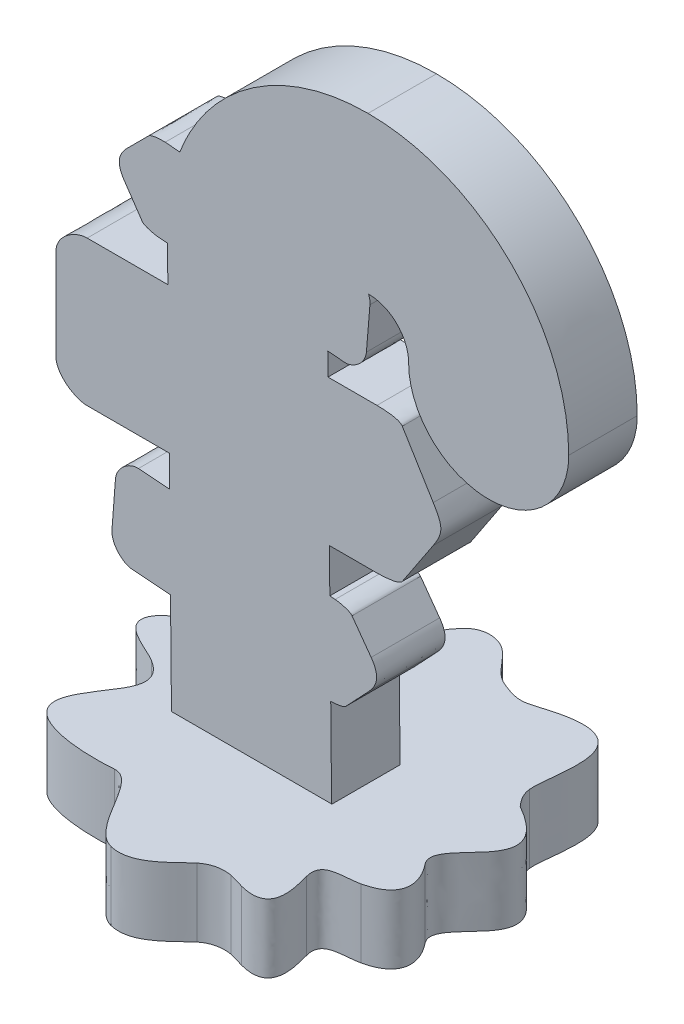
SolidWorks part; units mm, degrees
ref_plane "Front Plane" through (0, 0, 0) normal (0, 0, 1) x (1, 0, 0)
ref_plane "Top Plane" through (0, 0, 0) normal (0, 1, 0) x (1, 0, 0)
ref_plane "Right Plane" through (0, 0, 0) normal (1, 0, 0) x (0, 0, -1)
sketch "Sketch1" plane through (0, 0, 0) normal (0, 1, 0) x (1, 0, 0)
  spline S0 degree 3 poles (420.8176, 401.4154) (421.2862, 400.2379) (422.0432, 399.4519) (421.854, 398.1624) knots 0 0 0 0 0.047619 0.047619 0.047619 0.047619
  spline S1 degree 3 poles (421.854, 398.1624) (421.6954, 397.0807) (418.8198, 397.13) (417.9227, 396.1752) knots 0.047619 0.047619 0.047619 0.047619 0.095238 0.095238 0.095238 0.095238
  spline S2 degree 3 poles (417.9227, 396.1752) (416.2528, 394.3977) (419.3237, 393.6436) (420.4115, 392.9683) knots 0.095238 0.095238 0.095238 0.095238 0.142857 0.142857 0.142857 0.142857
  spline S3 degree 3 poles (420.4115, 392.9683) (423.0649, 391.3211) (420.2278, 389.6098) (419.5455, 387.4291) knots 0.142857 0.142857 0.142857 0.142857 0.190476 0.190476 0.190476 0.190476
  spline S4 degree 3 poles (419.5455, 387.4291) (418.6859, 384.6811) (424.0104, 384.5689) (425.9259, 384.7447) knots 0.190476 0.190476 0.190476 0.190476 0.238095 0.238095 0.238095 0.238095
  spline S5 degree 3 poles (425.9259, 384.7447) (427.5779, 384.8832) (428.6865, 380.2363) (430.6948, 379.7275) knots 0.238095 0.238095 0.238095 0.238095 0.285714 0.285714 0.285714 0.285714
  spline S6 degree 3 poles (430.6948, 379.7275) (432.5884, 379.2478) (433.9449, 381.0473) (434.8801, 381.8177) knots 0.285714 0.285714 0.285714 0.285714 0.333333 0.333333 0.333333 0.333333
  spline S7 degree 3 poles (434.8801, 381.8177) (435.3935, 382.2407) (436.0889, 382.4324) (436.8727, 382.2946) knots 0.333333 0.333333 0.333333 0.333333 0.380952 0.380952 0.380952 0.380952
  spline S8 degree 3 poles (436.8727, 382.2946) (437.1556, 382.2449) (437.654, 382.0683) (437.9809, 381.9822) knots 0.380952 0.380952 0.380952 0.380952 0.428571 0.428571 0.428571 0.428571
  spline S9 degree 3 poles (437.9809, 381.9822) (440.8072, 381.238) (440.0455, 383.7541) (439.7236, 384.9904) knots 0.428571 0.428571 0.428571 0.428571 0.47619 0.47619 0.47619 0.47619
  spline S10 degree 3 poles (439.7236, 384.9904) (439.3146, 386.5615) (441.0365, 386.2345) (442.178, 386.4862) knots 0.47619 0.47619 0.47619 0.47619 0.52381 0.52381 0.52381 0.52381
  spline S11 degree 3 poles (442.178, 386.4862) (444.4601, 386.9894) (444.547, 388.4992) (443.2653, 390.0937) knots 0.52381 0.52381 0.52381 0.52381 0.571429 0.571429 0.571429 0.571429
  spline S12 degree 3 poles (443.2653, 390.0937) (441.7873, 392.1014) (448.9236, 393.9394) (443.1314, 397.1708) knots 0.571429 0.571429 0.571429 0.571429 0.619048 0.619048 0.619048 0.619048
  spline S13 degree 3 poles (443.1314, 397.1708) (442.7526, 397.5732) (442.4255, 398.0599) (442.365, 398.6158) knots 0.619048 0.619048 0.619048 0.619048 0.666667 0.666667 0.666667 0.666667
  spline S14 degree 3 poles (442.365, 398.6158) (442.1632, 400.4684) (444.2579, 406.0472) (438.2903, 404.3764) knots 0.666667 0.666667 0.666667 0.666667 0.714286 0.714286 0.714286 0.714286
  spline S15 degree 3 poles (438.2903, 404.3764) (436.6482, 403.9166) (436.4757, 403.6768) (434.8514, 404.3426) knots 0.714286 0.714286 0.714286 0.714286 0.761905 0.761905 0.761905 0.761905
  spline S16 degree 3 poles (434.8514, 404.3426) (433.832, 404.7605) (433.4561, 405.6569) (432.609, 406.3887) knots 0.761905 0.761905 0.761905 0.761905 0.809524 0.809524 0.809524 0.809524
  spline S17 degree 3 poles (432.609, 406.3887) (431.7331, 407.1455) (430.4633, 407.1887) (429.7012, 406.3163) knots 0.809524 0.809524 0.809524 0.809524 0.857143 0.857143 0.857143 0.857143
  spline S18 degree 3 poles (429.7012, 406.3163) (428.0692, 404.4482) (428.9313, 402.9795) (425.0415, 403.8049) knots 0.857143 0.857143 0.857143 0.857143 0.904762 0.904762 0.904762 0.904762
  spline S19 degree 3 poles (425.0415, 403.8049) (422.8108, 404.2783) (419.6747, 404.2876) (420.8176, 401.4154) knots 0.904762 0.904762 0.904762 0.904762 1 1 1 1
extrude "Boss-Extrude1" add sketch "Sketch1" along normal blind 5
ref_plane "Plane2" through (0, 0, -392.9683) normal (0, 0, 1) x (1, 0, 0)
sketch "Sketch2" plane through (0, 0, -392.9683) normal (0, 0, 1) x (1, 0, 0)
  spline S0 degree 3 poles (424.9816, 40.6842) (427.0544, 46.1239) (432.4263, 50) (438.7223, 50) knots 0 0 0 0 0.020408 0.020408 0.020408 0.020408
  spline S1 degree 3 poles (438.7223, 50) (446.8134, 50) (453.3762, 43.5989) (453.3762, 35.7073) knots 0.020408 0.020408 0.020408 0.020408 0.040816 0.040816 0.040816 0.040816
  spline S2 degree 3 poles (453.3762, 35.7073) (453.3762, 32.5658) (450.7517, 30.006) (447.5308, 30.006) knots 0.040816 0.040816 0.040816 0.040816 0.061224 0.061224 0.061224 0.061224
  spline S3 degree 3 poles (447.5308, 30.006) (444.3098, 30.006) (441.6853, 32.5659) (441.6852, 35.7075) knots 0.061224 0.061224 0.061224 0.061224 0.081633 0.081633 0.081633 0.081633
  spline S4 degree 3 poles (441.6852, 35.7075) (441.6851, 37.293) (440.381, 38.5774) (438.7601, 38.5971) knots 0.081633 0.081633 0.081633 0.081633 0.102041 0.102041 0.102041 0.102041
  spline S5 degree 3 poles (438.7601, 38.5971) (438.8397, 38.399) (438.8796, 38.1845) (438.8614, 37.9644) knots 0.102041 0.102041 0.102041 0.102041 0.122449 0.122449 0.122449 0.122449
  spline S6 degree 2 poles (438.8614, 37.9644) (438.8614, 37.9644) (438.6032, 34.8407) knots 0.122449 0.122449 0.122449 0.142857 0.142857 0.142857
  spline S7 degree 3 poles (438.6032, 34.8407) (438.5321, 33.9804) (437.598, 33.3512) (437.0043, 33.4003) knots 0.142857 0.142857 0.142857 0.142857 0.163265 0.163265 0.163265 0.163265
  spline S8 degree 2 poles (437.0043, 33.4003) (437.0043, 33.4003) (435.7812, 33.5014) knots 0.163265 0.163265 0.163265 0.183673 0.183673 0.183673
  spline S9 degree 2 poles (435.7812, 33.5014) (435.7812, 33.5014) (435.7973, 31.8611) knots 0.183673 0.183673 0.183673 0.204082 0.204082 0.204082
  spline S10 degree 2 poles (435.7973, 31.8611) (435.7973, 31.8611) (439.3749, 31.8611) knots 0.204082 0.204082 0.204082 0.22449 0.22449 0.22449
  spline S11 degree 3 poles (439.3749, 31.8611) (439.7509, 31.8611) (441.0046, 31.8284) (441.2255, 31.4666) knots 0.22449 0.22449 0.22449 0.22449 0.244898 0.244898 0.244898 0.244898
  spline S12 degree 2 poles (441.2255, 31.4666) (441.2255, 31.4666) (443.4844, 27.7666) knots 0.244898 0.244898 0.244898 0.265306 0.265306 0.265306
  spline S13 degree 3 poles (443.4844, 27.7666) (444.2187, 26.564) (444.2263, 26.1723) (443.4844, 25.0556) knots 0.265306 0.265306 0.265306 0.265306 0.285714 0.285714 0.285714 0.285714
  spline S14 degree 2 poles (443.4844, 25.0556) (443.4844, 25.0556) (441.2255, 21.6556) knots 0.285714 0.285714 0.285714 0.306122 0.306122 0.306122
  spline S15 degree 3 poles (441.2255, 21.6556) (440.9932, 21.3059) (439.7495, 21.2611) (439.3749, 21.2611) knots 0.306122 0.306122 0.306122 0.306122 0.326531 0.326531 0.326531 0.326531
  spline S16 degree 2 poles (439.3749, 21.2611) (439.3749, 21.2611) (435.9019, 21.2611) knots 0.326531 0.326531 0.326531 0.346939 0.346939 0.346939
  spline S17 degree 2 poles (435.9019, 21.2611) (435.9019, 21.2611) (435.9332, 18.0938) knots 0.346939 0.346939 0.346939 0.367347 0.367347 0.367347
  spline S18 degree 2 poles (435.9332, 18.0938) (435.9332, 18.0938) (436.3233, 18.0641) knots 0.367347 0.367347 0.367347 0.387755 0.387755 0.387755
  spline S19 degree 3 poles (436.3233, 18.0641) (436.5786, 18.0446) (437.3755, 17.8915) (437.5552, 17.643) knots 0.387755 0.387755 0.387755 0.387755 0.408163 0.408163 0.408163 0.408163
  spline S20 degree 2 poles (437.5552, 17.643) (437.5552, 17.643) (438.951, 15.7121) knots 0.408163 0.408163 0.408163 0.428571 0.428571 0.428571
  spline S21 degree 3 poles (438.951, 15.7121) (439.5482, 14.886) (439.456, 14.1926) (438.7807, 13.4765) knots 0.428571 0.428571 0.428571 0.428571 0.44898 0.44898 0.44898 0.44898
  spline S22 degree 2 poles (438.7807, 13.4765) (438.7807, 13.4765) (437.1023, 11.6968) knots 0.44898 0.44898 0.44898 0.469388 0.469388 0.469388
  spline S23 degree 3 poles (437.1023, 11.6968) (436.9276, 11.5115) (436.3409, 11.4624) (435.9986, 11.4619) knots 0.469388 0.469388 0.469388 0.469388 0.489796 0.489796 0.489796 0.489796
  spline S24 degree 2 poles (435.9986, 11.4619) (435.9986, 11.4619) (436.0866, 2.5378) knots 0.489796 0.489796 0.489796 0.510204 0.510204 0.510204
  spline S25 degree 3 poles (436.0866, 2.5378) (436.0953, 1.6541) (435.8941, 0.7875) (435.5017, 0) knots 0.510204 0.510204 0.510204 0.510204 0.530612 0.530612 0.530612 0.530612
  spline S26 degree 2 poles (435.5017, 0) (435.5017, 0) (424.9809, 0) knots 0.530612 0.530612 0.530612 0.55102 0.55102 0.55102
  spline S27 degree 3 poles (424.9809, 0) (424.6051, 0.7542) (424.4047, 1.5811) (424.3963, 2.4278) knots 0.55102 0.55102 0.55102 0.55102 0.571429 0.571429 0.571429 0.571429
  spline S28 degree 2 poles (424.3963, 2.4278) (424.3963, 2.4278) (424.2985, 12.3449) knots 0.571429 0.571429 0.571429 0.591837 0.591837 0.591837
  spline S29 degree 2 poles (424.2985, 12.3449) (424.2985, 12.3449) (421.4528, 12.5617) knots 0.591837 0.591837 0.591837 0.612245 0.612245 0.612245
  spline S30 degree 3 poles (421.4528, 12.5617) (420.8258, 12.6094) (419.9572, 13.4207) (420.0264, 14.3291) knots 0.612245 0.612245 0.612245 0.612245 0.632653 0.632653 0.632653 0.632653
  spline S31 degree 2 poles (420.0264, 14.3291) (420.0264, 14.3291) (420.2776, 17.6275) knots 0.632653 0.632653 0.632653 0.653061 0.653061 0.653061
  spline S32 degree 3 poles (420.2776, 17.6275) (420.3468, 18.5359) (421.3277, 19.2064) (421.9553, 19.1585) knots 0.653061 0.653061 0.653061 0.653061 0.673469 0.673469 0.673469 0.673469
  spline S33 degree 2 poles (421.9553, 19.1585) (421.9553, 19.1585) (424.233, 18.985) knots 0.673469 0.673469 0.673469 0.693878 0.693878 0.693878
  spline S34 degree 2 poles (424.233, 18.985) (424.233, 18.985) (424.2105, 21.2611) knots 0.693878 0.693878 0.693878 0.714286 0.714286 0.714286
  spline S35 degree 2 poles (424.2105, 21.2611) (424.2105, 21.2611) (418.2166, 21.2611) knots 0.714286 0.714286 0.714286 0.734694 0.734694 0.734694
  spline S36 degree 3 poles (418.2166, 21.2611) (417.2935, 21.2611) (415.931, 22.1595) (415.931, 23.2611) knots 0.734694 0.734694 0.734694 0.734694 0.755102 0.755102 0.755102 0.755102
  spline S37 degree 2 poles (415.931, 23.2611) (415.931, 23.2611) (415.931, 29.8611) knots 0.755102 0.755102 0.755102 0.77551 0.77551 0.77551
  spline S38 degree 3 poles (415.931, 29.8611) (415.931, 30.9627) (417.2923, 31.8611) (418.2166, 31.8611) knots 0.77551 0.77551 0.77551 0.77551 0.795918 0.795918 0.795918 0.795918
  spline S39 degree 2 poles (418.2166, 31.8611) (418.2166, 31.8611) (424.106, 31.8611) knots 0.795918 0.795918 0.795918 0.816327 0.816327 0.816327
  spline S40 degree 2 poles (424.106, 31.8611) (424.106, 31.8611) (424.0803, 34.4686) knots 0.816327 0.816327 0.816327 0.836735 0.836735 0.836735
  spline S41 degree 2 poles (424.0803, 34.4686) (424.0803, 34.4686) (423.3973, 34.5251) knots 0.836735 0.836735 0.836735 0.857143 0.857143 0.857143
  spline S42 degree 3 poles (423.3973, 34.5251) (423.1563, 34.545) (422.3969, 34.6901) (422.2326, 34.9315) knots 0.857143 0.857143 0.857143 0.857143 0.877551 0.877551 0.877551 0.877551
  spline S43 degree 2 poles (422.2326, 34.9315) (422.2326, 34.9315) (420.9284, 36.8478) knots 0.877551 0.877551 0.877551 0.897959 0.897959 0.897959
  spline S44 degree 3 poles (420.9284, 36.8478) (420.4036, 37.6187) (420.4211, 38.2813) (421.1034, 38.9649) knots 0.897959 0.897959 0.897959 0.897959 0.918367 0.918367 0.918367 0.918367
  spline S45 degree 2 poles (421.1034, 38.9649) (421.1034, 38.9649) (422.6981, 40.5628) knots 0.918367 0.918367 0.918367 0.938776 0.938776 0.938776
  spline S46 degree 3 poles (422.6981, 40.5628) (422.9034, 40.7685) (423.6719, 40.7925) (423.9137, 40.7725) knots 0.938776 0.938776 0.938776 0.938776 0.959184 0.959184 0.959184 0.959184
  spline S47 degree 2 poles (423.9137, 40.7725) (423.9137, 40.7725) (424.9816, 40.6842) knots 0.959184 0.959184 0.959184 1 1 1
extrude "Boss-Extrude2" add sketch "Sketch2" along normal mid plane 5 separate body
sketch "Sketch3" plane through (0, 5, 0) normal (0, 1, 0) x (1, 0, 0)
  line L5 (436.0866, 390.4683) -> (436.0866, 395.4683) construction
  line L6 (424.3963, 390.4683) -> (424.3963, 395.4683) construction
  line L7 (436.0866, 390.4683) -> (436.0866, 395.4683)
  line L8 (424.3963, 390.4683) -> (424.3963, 395.4683)
  line L9 (424.3963, 390.4683) -> (436.0866, 390.4683)
  line L10 (424.3963, 395.4683) -> (436.0866, 395.4683)
extrude "Cut-Extrude1" cut sketch "Sketch3" against normal blind 5
